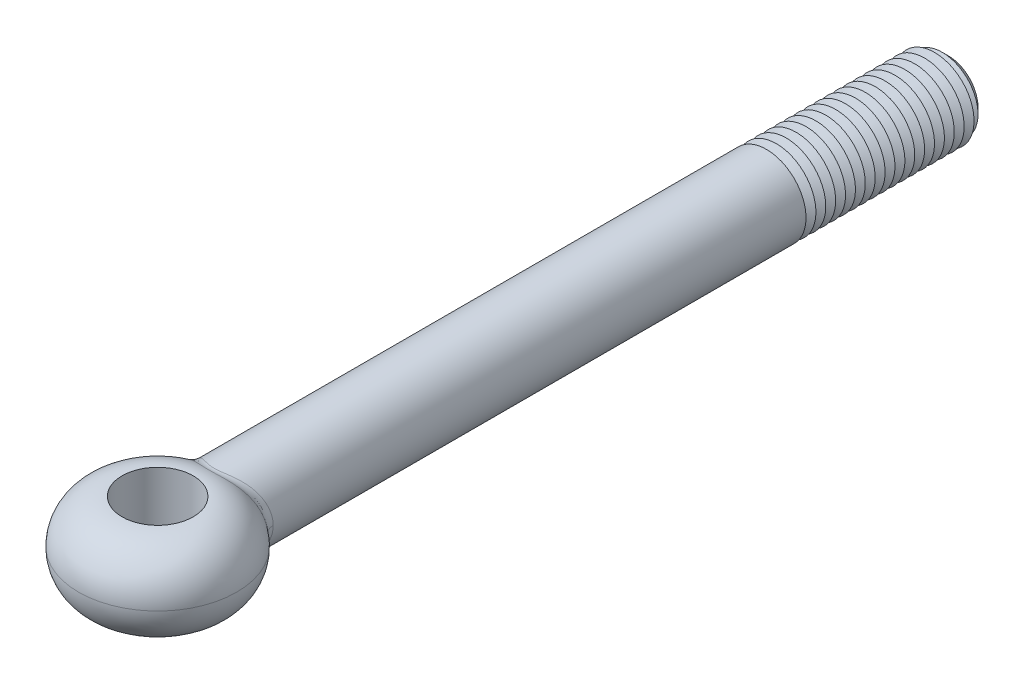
SolidWorks part; units mm, degrees
ref_plane "Front Plane" through (0, 0, 0) normal (0, 0, 1) x (1, 0, 0)
ref_plane "Top Plane" through (0, 0, 0) normal (0, 1, 0) x (1, 0, 0)
ref_plane "Right Plane" through (0, 0, 0) normal (1, 0, 0) x (0, 0, -1)
sketch "Sketch7" plane through (0, 0, 0) normal (0, 1, 0) x (1, 0, 0)
  circle A0 centre (0, 0) radius 20
  dimension "D1" = 40
extrude "Boss-Extrude3" add sketch "Sketch7" along normal mid plane 22
sketch "Sketch8" plane through (0, 0, 0) normal (0, 0, 1) x (1, 0, 0)
  circle A0 centre (0, 0) radius 10
  dimension "D1" = 20
extrude "Boss-Extrude4" add sketch "Sketch8" against normal blind 200
fillet "Fillet5" radius 11 2 edges at (0, -11, 20) (0, 11, 20)
fillet "Fillet6" radius 3.5 2 edges at (0.8553, -9.9634, -13.6349) (-0.8553, 9.9634, -13.6349)
chamfer "Chamfer1" distance 2.5 angle 45 1 edges at (10, 0, -200)
sketch "Sketch10" plane through (0, 0, 0) normal (0, 1, 0) x (1, 0, 0)
  line L0 (0, 28.1405) -> (0, -7.9233) construction
sketch "Sketch11" plane through (0, 0, 0) normal (0, 1, 0) x (1, 0, 0)
  line L0 (-10, 154) -> (-7.8349, 155.25)
  line L1 (-10, 197.5) -> (-10, 19.2354) construction
  line L2 (-7.8349, 155.25) -> (-10, 156.5)
  line L3 (-10, 156.5) -> (-10, 154)
  line L4 (7.5, 200) -> (-7.5, 200) construction
  dimension "D1" = 2.5
  dimension "D2" = 46
revolve "Cut-Revolve1" cut sketch "Sketch11" angle 360 about L0
pattern_linear "LPattern1" count 18 spacing 2.5 along (0, 0, -1) of "Cut-Revolve1"
sketch "Sketch12" plane through (0, 0, 0) normal (0, 1, 0) x (1, 0, 0)
  circle A0 centre (0, 0) radius 9
  dimension "D1" = 18
extrude "Cut-Extrude1" cut sketch "Sketch12" against normal mid plane 22
